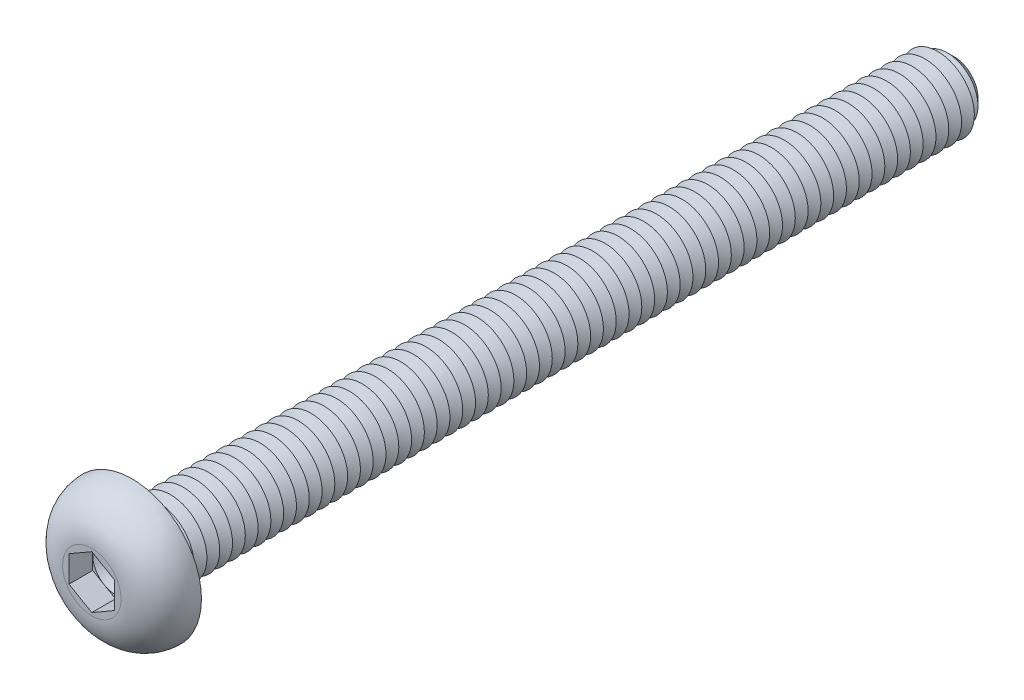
SolidWorks part; units mm, degrees
ref_plane "Front Plane" through (0, 0, 0) normal (0, 0, 1) x (1, 0, 0)
ref_plane "Top Plane" through (0, 0, 0) normal (0, 1, 0) x (1, 0, 0)
ref_plane "Right Plane" through (0, 0, 0) normal (1, 0, 0) x (0, 0, -1)
sketch "Sketch1" plane through (0, 0, 0) normal (1, 0, 0) x (0, 0, -1)
  line L0 (-47.9342, 0) -> (60.3146, 0) construction
sketch "Sketch2" plane through (0, 0, 0) normal (1, 0, 0) x (0, 0, -1)
  line L0 (0, 0) -> (-2.2, 0)
  line L1 (-47.9342, 0) -> (60.3146, 0) construction
  line L2 (-2.2, 0) -> (-2.2, 1.6)
  line L3 (0, 3.8) -> (0, 0)
  arc A0 (-2.2, 1.6) -> (0, 3.8) centre (0, 1.6) cw
  dimension "D1" = 2.2
  dimension "D2" = 2.2
  dimension "D3" = 3.8
revolve "Revolve1" add sketch "Sketch2" angle 360 about L0
sketch "Sketch3" plane through (0, 0, 2.2) normal (0, 0, 1) x (1, 0, 0)
  line L1 (0, 1.4434) -> (-1.25, 0.7217)
  line L2 (-1.25, 0.7217) -> (-1.25, -0.7217)
  line L3 (-1.25, -0.7217) -> (0, -1.4434)
  line L4 (0, -1.4434) -> (1.25, -0.7217)
  line L5 (1.25, -0.7217) -> (1.25, 0.7217)
  line L6 (1.25, 0.7217) -> (0, 1.4434)
  circle A0 centre (0, 0) radius 1.25 construction
  dimension "D1" = 2.5
extrude "Cut-Extrude1" cut sketch "Sketch3" against normal blind 1.3
sketch "Sketch4" plane through (0, 0, 0) normal (0, 0, -1) x (-1, 0, 0)
  circle A0 centre (0, 0) radius 2
  dimension "D1" = 4
extrude "Boss-Extrude1" add sketch "Sketch4" along normal blind 45
chamfer "Chamfer1" distance 0.7 angle 45 1 edges at (-2, 0, -45)
sketch "Sketch5" plane through (0, 0, 0) normal (1, 0, 0) x (0, 0, -1)
  line L0 (0.7, 2) -> (1.4, 2)
  line L1 (44.3, 2) -> (0, 2) construction
  line L2 (1.4, 2) -> (1.05, 1.3938)
  line L3 (1.05, 1.3938) -> (0.7, 2)
  line L4 (0, -3.8) -> (0, 3.8) construction
  line L5 (44.3, 2) -> (0, 2) construction
  dimension "D1" = 0.7
  dimension "D2" = 0.7
revolve "Cut-Revolve1" cut sketch "Sketch5" angle 360 about L0
pattern_linear "LPattern1" count 63 spacing 0.7 along (0, 0, -1) of "Cut-Revolve1"
fillet "Fillet2" radius 0.3 1 edges at (2, 0, 0)
sketch "Sketch6" plane through (0, 0, 0.9) normal (0, 0, 1) x (1, 0, 0)
  line L0 (0, -1.4434) -> (1.25, -0.7217) construction
  circle A0 centre (0, 0) radius 1.25
extrude "Cut-Extrude2" cut sketch "Sketch6" against normal through all draft 60
